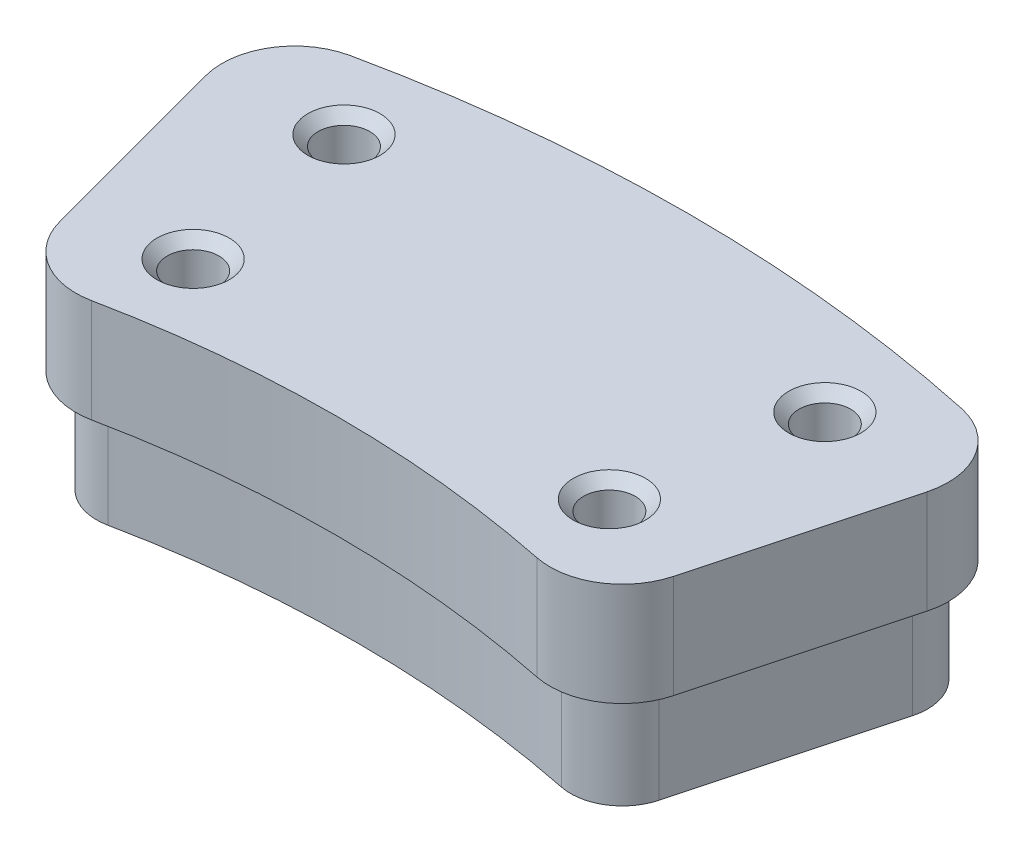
SolidWorks part; units mm, degrees
ref_plane "Front" through (0, 0, 0) normal (0, 0, 1) x (1, 0, 0)
ref_plane "Top" through (0, 0, 0) normal (0, 1, 0) x (1, 0, 0)
ref_plane "Right" through (0, 0, 0) normal (1, 0, 0) x (0, 0, -1)
sketch "Sketch1" plane through (0, 0, 0) normal (0, 1, 0) x (1, 0, 0)
  line L0 (0, 0) -> (-27.9525, 104.32) construction
  line L1 (-27.9525, 104.32) -> (-36.7523, 137.1615)
  line L2 (0, 0) -> (27.9525, 104.32) construction
  line L3 (27.9525, 104.32) -> (36.7523, 137.1615)
  line L4 (0, 0) -> (0, 108) construction
  arc A0 (36.7523, 137.1615) -> (-36.7523, 137.1615) centre (0, 0) ccw
  arc A1 (27.9525, 104.32) -> (-27.9525, 104.32) centre (0, 0) ccw
  dimension "D1" = 284
  dimension "D2" = 216
  dimension "D3" = 30
extrude "Boss-Extrude1" add sketch "Sketch1" along normal blind 20
hole_wizard "M6 Tapped Hole1" positions "Sketch3" profile "Sketch4" tap size "M6" standard "ISO"
sketch "Sketch3" plane through (0, 20, 0) normal (0, 1, 0) x (-1, 0, 0)
  line L0 (0, 0) -> (-20.1432, -114.2377) construction
  line L1 (-20.1432, -114.2377) -> (-23.2689, -131.9642) construction
  line L4 (0, 0) -> (20.1432, -114.2377) construction
  line L5 (20.1432, -114.2377) -> (23.2689, -131.9642) construction
  line L8 (0, 0) -> (0, -116) construction
  circle A0 centre (0, 0) radius 134 construction
  circle A1 centre (0, 0) radius 116 construction
  point P0 (20.1432, -114.2377)
  point P1 (-20.1432, -114.2377)
  point P3 (-23.2689, -131.9642)
  point P5 (23.2689, -131.9642)
  dimension "D1" = 232
  dimension "D2" = 268
  dimension "D3" = 20
sketch "Sketch4" plane through (-20.1432, 20, -114.2377) normal (1, 0, 0) x (0, 0, 1)
  line L0 (0, 0) -> (0, 20)
  line L1 (0, 20) -> (2.5, 20)
  line L2 (2.5, 20) -> (2.5, 1)
  line L3 (2.5, 1) -> (3.5, 0)
  line L5 (3.5, 0) -> (0, 0)
  line L6 (-2.5, 1) -> (-3.5, 0) construction
  line L11 (0, -6.35) -> (0, 107.95) construction
  dimension "Thru Tap Drill Dia." = 5
  dimension "Thru Tap Drill Depth" = 20
  dimension "Near C'Sink Dia." = 7
  dimension "Near C'Sink Angle" = 90
sketch "Sketch5" plane through (0, 0, 0) normal (0, 1, 0) x (1, 0, 0)
  line L4 (-34.2991, 135.7335) -> (-26.5335, 106.7519)
  line L5 (26.5335, 106.7519) -> (34.2991, 135.7335)
  line L6 (-34.2991, 135.7335) -> (-26.5335, 106.7519)
  line L7 (26.5335, 106.7519) -> (34.2991, 135.7335)
  arc A4 (26.5335, 106.7519) -> (-26.5335, 106.7519) centre (0, 0) ccw
  arc A5 (34.2991, 135.7335) -> (-34.2991, 135.7335) centre (0, 0) ccw
  arc A6 (26.5335, 106.7519) -> (-26.5335, 106.7519) centre (0, 0) ccw
  arc A7 (34.2991, 135.7335) -> (-34.2991, 135.7335) centre (0, 0) ccw
  dimension "D1" = 2
extrude "Cut-Extrude2" cut sketch "Sketch5" along normal blind 10 flip side to cut
fillet "Fillet1" radius 5 4 edges at (-26.5335, 5, -106.7519) (-34.2991, 5, -135.7335) (26.5335, 5, -106.7519) (34.2991, 5, -135.7335)
fillet "Fillet2" radius 7 4 edges at (-27.9525, 15, -104.32) (-36.7523, 15, -137.1615) (27.9525, 15, -104.32) (36.7523, 15, -137.1615)
